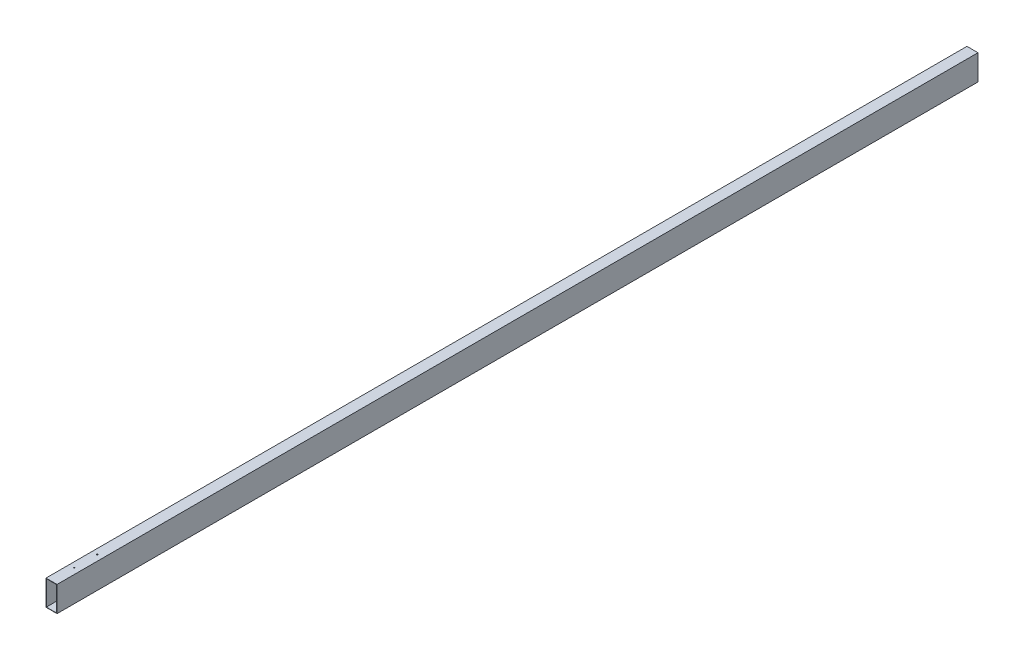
SolidWorks part; units mm, degrees
ref_plane "Front Plane" through (0, 0, 0) normal (0, 0, 1) x (1, 0, 0)
ref_plane "Top Plane" through (0, 0, 0) normal (0, 1, 0) x (1, 0, 0)
ref_plane "Right Plane" through (0, 0, 0) normal (1, 0, 0) x (0, 0, -1)
sketch "Sketch2" plane through (0, 0, 0) normal (0, 0, 1) x (1, 0, 0)
  line L0 (-24, 55) -> (24, 55)
  line L1 (-22.5, -53.5) -> (22.5, -53.5)
  line L2 (-22.5, -53.5) -> (-22.5, 53.5)
  line L3 (-22.5, 53.5) -> (22.5, 53.5)
  line L4 (22.5, -53.5) -> (22.5, 53.5)
  line L5 (-22.5, -53.5) -> (22.5, 53.5) construction
  line L6 (-22.5, 53.5) -> (22.5, -53.5) construction
  line L7 (24, -55) -> (24, 55)
  line L8 (-24, -55) -> (24, -55)
  line L9 (-24, -55) -> (-24, 55)
  point P0 (0, 0)
  dimension "D1" = 45
  dimension "D2" = 107
  dimension "D3" = 1.5
extrude "Boss-Extrude1" add sketch "Sketch2" along normal blind 4000
sketch "Sketch3" plane through (0, 55, 0) normal (0, 1, 0) x (1, 0, 0)
  line L0 (-24, -4000) -> (-24, 0) construction
  line L1 (24, -4000) -> (-24, -4000) construction
  point P0 (-1.5, -3900)
  dimension "D1" = 22.5
  dimension "D2" = 100
hole_wizard "Ø5.0mm Dowel Slot1" positions "Sketch4" profile "Sketch5" size "Ø5.0" standard "ISO"
sketch "Sketch4" plane through (0, 55, 0) normal (0, 1, 0) x (1, 0, 0)
  point P0 (-1.5, -3900)
sketch "Sketch5" plane through (-1.5, 55, 3900) normal (1, 0, 0) x (0, 0, 1)
  line L0 (0, 0) -> (0, 11.5522)
  line L1 (0, 11.5522) -> (2.5, 10.05)
  line L2 (2.5, 10.05) -> (2.5, 0)
  line L5 (2.5, 0) -> (0, 0)
  line L10 (0, 11.5522) -> (-2.5, 10.05) construction
  line L11 (0, -6.35) -> (0, 107.95) construction
  dimension "Hole Dia." = 5
  dimension "Hole Depth" = 10.05
  dimension "Drill Angle" = 118
pattern_linear "LPattern1" count 2 spacing 100 along (0, 0, -1) of "Ø5.0mm Dowel Slot1"
hole_wizard "Ø5.0mm Dowel Slot2" positions "Sketch6" profile "Sketch7" size "Ø5.0" standard "ISO"
sketch "Sketch6" plane through (0, -55, 0) normal (0, -1, 0) x (-1, 0, 0)
  point P0 (1.5, -3900)
sketch "Sketch7" plane through (-1.5, -55, 3900) normal (1, 0, 0) x (0, 0, -1)
  line L0 (0, 0) -> (0, 11.5522)
  line L1 (0, 11.5522) -> (2.5, 10.05)
  line L2 (2.5, 10.05) -> (2.5, 0)
  line L5 (2.5, 0) -> (0, 0)
  line L10 (0, 11.5522) -> (-2.5, 10.05) construction
  line L11 (0, -6.35) -> (0, 107.95) construction
  dimension "Hole Dia." = 5
  dimension "Hole Depth" = 10.05
  dimension "Drill Angle" = 118
pattern_linear "LPattern2" count 2 spacing 100 along (0, 0, -1) of "Ø5.0mm Dowel Slot2"
sketch "Sketch8" plane through (-24, 0, 0) normal (-1, 0, 0) x (0, 0, 1)
  line L0 (4000, 55) -> (4000, -55) construction
  line L1 (4000, 55) -> (0, 55) construction
  point P0 (3900.1251, 5)
  point P3 (4000, 0)
  dimension "D1" = 100
  dimension "D2" = 50
sketch "Sketch11" plane through (-24, 0, 0) normal (-1, 0, 0) x (0, 0, 1)
  line L0 (4000, 55) -> (4000, -55) construction
  line L1 (4000, 55) -> (0, 55) construction
  circle A0 centre (3850, 5) radius 15
  dimension "D3" = 30
  dimension "D1" = 150
  dimension "D2" = 50
extrude "Cut-Extrude1" cut sketch "Sketch11" against normal blind 10
